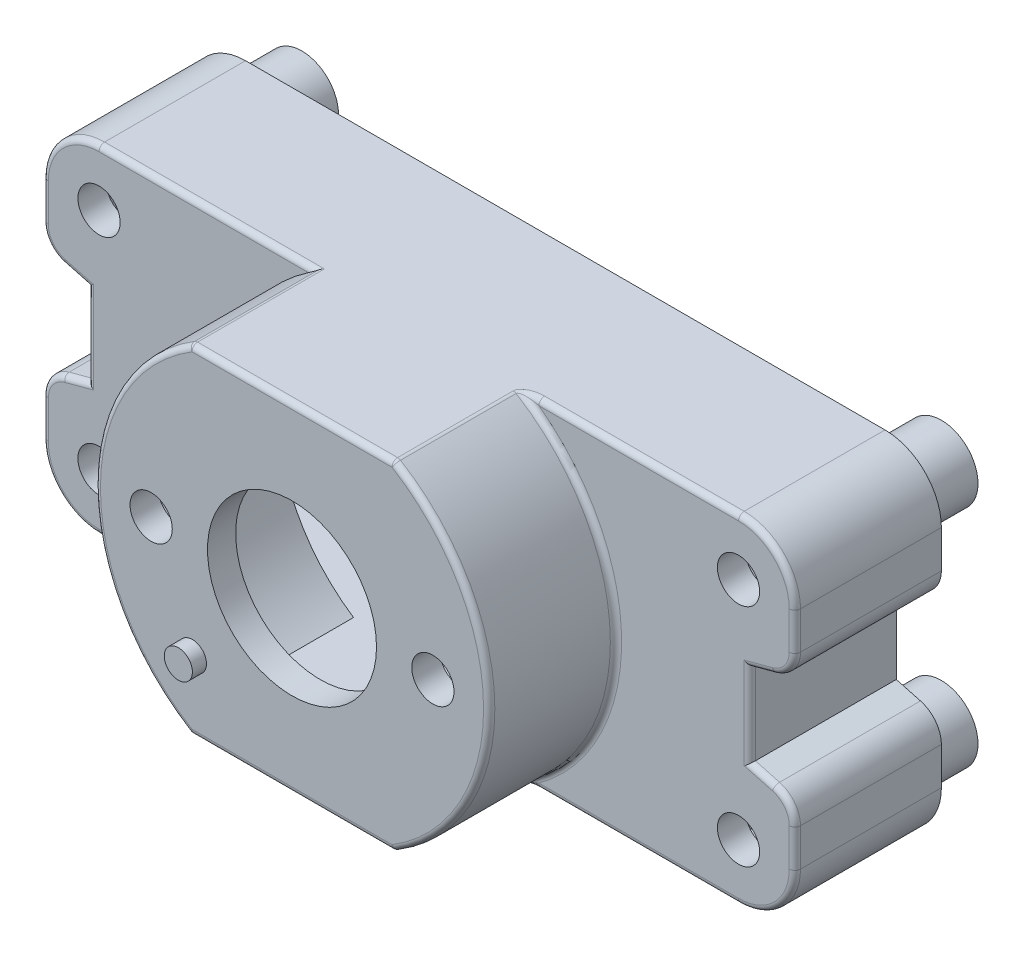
SolidWorks part; units mm, degrees
ref_plane "Plan de face" through (0, 0, 0) normal (0, 0, 1) x (1, 0, 0)
ref_plane "Plan de dessus" through (0, 0, 0) normal (0, 1, 0) x (1, 0, 0)
ref_plane "Plan de droite" through (0, 0, 0) normal (1, 0, 0) x (0, 0, -1)
sketch "Esquisse1" plane through (0, 0, 0) normal (0, 0, 1) x (1, 0, 0)
  line L0 (-9.25, -3.9) -> (-9.25, -5) construction
  line L1 (-9.25, -5) -> (9.25, -5) construction
  line L2 (9.25, -3.9) -> (9.25, -5) construction
  line L3 (10.75, 1.9635) -> (10.75, -1.9635) construction
  line L4 (9.25, 3.9) -> (9.25, 5) construction
  line L5 (-9.25, 5) -> (9.25, 5) construction
  line L6 (-9.25, 3.9) -> (-9.25, 5) construction
  line L7 (-10.75, 1.9635) -> (-10.75, -1.9635) construction
  line L8 (-9.25, -3.9) -> (-9.25, -5)
  line L9 (-9.25, -5) -> (9.25, -5)
  line L10 (9.25, -3.9) -> (9.25, -5)
  line L11 (10.75, 1.9635) -> (10.75, -1.9635)
  line L12 (11.35, 6) -> (-11.35, 6)
  line L13 (-13.35, 4) -> (-13.35, 1.9)
  line L14 (-13.35, 1.9) -> (-11.75, 1.4713)
  line L15 (-11.75, 1.4713) -> (-11.75, -1.4713)
  line L16 (-11.75, -1.4713) -> (-13.35, -1.9)
  line L17 (-13.35, -1.9) -> (-13.35, -4)
  line L18 (-11.35, -6) -> (11.35, -6)
  line L19 (13.35, -4) -> (13.35, -1.9)
  line L20 (13.35, -1.9) -> (11.75, -1.4713)
  line L21 (11.75, -1.4713) -> (11.75, 1.4713)
  line L22 (11.75, 1.4713) -> (13.35, 1.9)
  line L23 (13.35, 1.9) -> (13.35, 4)
  line L24 (11.35, 6) -> (-11.35, 6)
  line L25 (-13.35, 4) -> (-13.35, 2.6673)
  line L26 (-12.6088, 1.7014) -> (-11.75, 1.4713)
  line L27 (-11.75, 1.4713) -> (-11.75, -1.4713)
  line L28 (-11.75, -1.4713) -> (-12.6088, -1.7014)
  line L29 (-13.35, -2.6673) -> (-13.35, -4)
  line L30 (-11.35, -6) -> (11.35, -6)
  line L31 (13.35, -4) -> (13.35, -2.6673)
  line L32 (12.6088, -1.7014) -> (11.75, -1.4713)
  line L33 (11.75, -1.4713) -> (11.75, 1.4713)
  line L34 (11.75, 1.4713) -> (12.6088, 1.7014)
  line L35 (13.35, 2.6673) -> (13.35, 4)
  line L36 (9.25, 3.9) -> (9.25, 5)
  line L37 (-9.25, 5) -> (9.25, 5)
  line L38 (-9.25, 3.9) -> (-9.25, 5)
  line L39 (-10.75, 1.9635) -> (-10.75, -1.9635)
  arc A0 (-9.25, -3.9) -> (-10.75, -1.9635) centre (-11.25, -3.9) ccw construction
  arc A1 (10.75, -1.9635) -> (9.25, -3.9) centre (11.25, -3.9) ccw construction
  arc A2 (9.25, 3.9) -> (10.75, 1.9635) centre (11.25, 3.9) ccw construction
  arc A3 (-10.75, 1.9635) -> (-9.25, 3.9) centre (-11.25, 3.9) ccw construction
  arc A4 (-11.35, 6) -> (-13.35, 4) centre (-11.35, 4) ccw
  arc A5 (-13.35, -4) -> (-11.35, -6) centre (-11.35, -4) ccw
  arc A6 (11.35, -6) -> (13.35, -4) centre (11.35, -4) ccw
  arc A7 (13.35, 4) -> (11.35, 6) centre (11.35, 4) ccw
  arc A8 (-11.35, 6) -> (-13.35, 4) centre (-11.35, 4) ccw
  arc A9 (-13.35, -4) -> (-11.35, -6) centre (-11.35, -4) ccw
  arc A10 (11.35, -6) -> (13.35, -4) centre (11.35, -4) ccw
  arc A11 (13.35, 4) -> (11.35, 6) centre (11.35, 4) ccw
  arc A12 (-9.25, -3.9) -> (-10.75, -1.9635) centre (-11.25, -3.9) ccw
  arc A13 (10.75, -1.9635) -> (9.25, -3.9) centre (11.25, -3.9) ccw
  arc A14 (9.25, 3.9) -> (10.75, 1.9635) centre (11.25, 3.9) ccw
  arc A15 (-10.75, 1.9635) -> (-9.25, 3.9) centre (-11.25, 3.9) ccw
  arc A16 (13.35, 2.6673) -> (12.6088, 1.7014) centre (12.35, 2.6673) cw
  arc A17 (13.35, -2.6673) -> (12.6088, -1.7014) centre (12.35, -2.6673) ccw
  arc A18 (-13.35, -2.6673) -> (-12.6088, -1.7014) centre (-12.35, -2.6673) cw
  arc A19 (-13.35, 2.6673) -> (-12.6088, 1.7014) centre (-12.35, 2.6673) ccw
  dimension "D2" = 1
  dimension "D1" = 0
extrude "Extrusion1" add sketch "Esquisse1" along normal blind 5.2
sketch "Esquisse2" plane through (0, 0, 5.2) normal (0, 0, 1) x (1, 0, 0)
  line L12 (11.35, 6) -> (-11.35, 6)
  line L13 (-13.35, 4) -> (-13.35, 2.6673)
  line L14 (-12.6088, 1.7014) -> (-11.75, 1.4713)
  line L15 (-11.75, 1.4713) -> (-11.75, -1.4713)
  line L16 (-11.75, -1.4713) -> (-12.6088, -1.7014)
  line L17 (-13.35, -2.6673) -> (-13.35, -4)
  line L18 (-11.35, -6) -> (11.35, -6)
  line L19 (13.35, -4) -> (13.35, -2.6673)
  line L20 (12.6088, -1.7014) -> (11.75, -1.4713)
  line L21 (11.75, -1.4713) -> (11.75, 1.4713)
  line L22 (11.75, 1.4713) -> (12.6088, 1.7014)
  line L23 (13.35, 2.6673) -> (13.35, 4)
  line L24 (11.35, 6) -> (-11.35, 6)
  line L25 (-13.35, 4) -> (-13.35, 2.6673)
  line L26 (-12.6088, 1.7014) -> (-11.75, 1.4713)
  line L27 (-11.75, 1.4713) -> (-11.75, -1.4713)
  line L28 (-11.75, -1.4713) -> (-12.6088, -1.7014)
  line L29 (-13.35, -2.6673) -> (-13.35, -4)
  line L30 (-11.35, -6) -> (11.35, -6)
  line L31 (13.35, -4) -> (13.35, -2.6673)
  line L32 (12.6088, -1.7014) -> (11.75, -1.4713)
  line L33 (11.75, -1.4713) -> (11.75, 1.4713)
  line L34 (11.75, 1.4713) -> (12.6088, 1.7014)
  line L35 (13.35, 2.6673) -> (13.35, 4)
  arc A8 (13.35, 4) -> (11.35, 6) centre (11.35, 4) ccw
  arc A9 (-11.35, 6) -> (-13.35, 4) centre (-11.35, 4) ccw
  arc A10 (-13.35, 2.6673) -> (-12.6088, 1.7014) centre (-12.35, 2.6673) ccw
  arc A11 (-12.6088, -1.7014) -> (-13.35, -2.6673) centre (-12.35, -2.6673) ccw
  arc A12 (-13.35, -4) -> (-11.35, -6) centre (-11.35, -4) ccw
  arc A13 (11.35, -6) -> (13.35, -4) centre (11.35, -4) ccw
  arc A14 (13.35, -2.6673) -> (12.6088, -1.7014) centre (12.35, -2.6673) ccw
  arc A15 (12.6088, 1.7014) -> (13.35, 2.6673) centre (12.35, 2.6673) ccw
  arc A16 (13.35, 4) -> (11.35, 6) centre (11.35, 4) ccw
  arc A17 (-11.35, 6) -> (-13.35, 4) centre (-11.35, 4) ccw
  arc A18 (-13.35, 2.6673) -> (-12.6088, 1.7014) centre (-12.35, 2.6673) ccw
  arc A19 (-12.6088, -1.7014) -> (-13.35, -2.6673) centre (-12.35, -2.6673) ccw
  arc A20 (-13.35, -4) -> (-11.35, -6) centre (-11.35, -4) ccw
  arc A21 (11.35, -6) -> (13.35, -4) centre (11.35, -4) ccw
  arc A22 (13.35, -2.6673) -> (12.6088, -1.7014) centre (12.35, -2.6673) ccw
  arc A23 (12.6088, 1.7014) -> (13.35, 2.6673) centre (12.35, 2.6673) ccw
  dimension "D1" = 0
extrude "Extrusion2" add sketch "Esquisse2" against normal blind 1
sketch "Esquisse3" plane through (0, 0, 5.2) normal (0, 0, 1) x (1, 0, 0)
  line L0 (-3.6056, 6) -> (3.6056, 6)
  line L1 (11.35, 6) -> (-11.35, 6) construction
  line L2 (3.6056, -6) -> (-3.6056, -6)
  line L3 (-11.35, -6) -> (11.35, -6) construction
  arc A0 (-3.6056, 6) -> (-3.6056, -6) centre (0, 0) ccw
  arc A1 (3.6056, -6) -> (3.6056, 6) centre (0, 0) ccw
  dimension "D1" = 14
extrude "Extrusion3" add sketch "Esquisse3" along normal blind 4.5
shell "Coque1" thickness 1
sketch "Esquisse4" plane through (0, 0, 0) normal (0, 0, -1) x (-1, 0, 0)
  circle A0 centre (-11.35, -4) radius 1.3 construction
  circle A1 centre (-11.35, 4) radius 1.3 construction
  circle A2 centre (11.35, -4) radius 1.3 construction
  circle A3 centre (11.35, 4) radius 1.3 construction
  circle A4 centre (-11.35, -4) radius 1.3
  circle A5 centre (-11.35, 4) radius 1.3
  circle A6 centre (11.35, -4) radius 1.3
  circle A7 centre (11.35, 4) radius 1.3
extrude "Extrusion4" add sketch "Esquisse4" along normal up to surface (2 mm away)
sketch "Esquisse5" plane through (0, 0, -2) normal (0, 0, -1) x (-1, 0, 0)
  line L1 (0, -7.283) -> (0, 7.9067) construction
  line L5 (14.2543, 0) -> (-14.2543, 0) construction
  circle A0 centre (0, 0) radius 3
  circle A2 centre (11.35, 4) radius 0.75 construction
  circle A3 centre (-11.35, 4) radius 0.75 construction
  circle A4 centre (-11.35, -4) radius 0.75 construction
  circle A5 centre (11.35, -4) radius 0.75 construction
  circle A6 centre (-11.35, 4) radius 0.75
  circle A7 centre (-11.35, -4) radius 0.75
  circle A8 centre (11.35, -4) radius 0.75
  circle A9 centre (11.35, 4) radius 0.75
  circle A10 centre (-5, 0) radius 0.75
  circle A11 centre (5, 0) radius 0.75
  dimension "D1" = 6
  dimension "D2" = 10
  dimension "D3" = 1.5
  dimension "D4" = 1.5
extrude "Enlèv. mat.-Extru.1" cut sketch "Esquisse5" against normal through all
sketch "Esquisse6" plane through (0, 0, 4.2) normal (0, 0, -1) x (-1, 0, 0)
  line L2 (-5.875, 1.2183) -> (5.875, 1.2183)
  line L3 (5.875, -1.2183) -> (-5.875, -1.2183)
  arc A0 (-5.875, 1.2183) -> (-5.875, -1.2183) centre (-5, 0) ccw
  arc A2 (5.875, 1.2183) -> (5.875, -1.2183) centre (5, 0) cw
  circle A4 centre (5, 0) radius 0.75 construction
  circle A5 centre (-5, 0) radius 0.75 construction
  arc A9 (3.3166, -5) -> (3.3166, 5) centre (0, 0) ccw construction
  arc A10 (-3.3166, 5) -> (-3.3166, -5) centre (0, 0) ccw construction
  dimension "D1" = 1.5
  dimension "D2" = 1.5
extrude "Enlèv. mat.-Extru.2" cut sketch "Esquisse6" against normal up to surface (4.5 mm away)
sketch "Esquisse7" plane through (0, 0, 9.7) normal (0, 0, 1) x (1, 0, 0)
  line L2 (5, 0) -> (-14.2543, 0) construction
  line L3 (0, 0) -> (-3.5355, -3.5355) construction
  circle A0 centre (-3.5355, -3.5355) radius 0.5
  circle A4 centre (0, 0) radius 5 construction
  circle A5 centre (5, 0) radius 0.75 construction
  point P4 (5, 0)
  dimension "D1" = 1
  dimension "D3" = 45
extrude "Extrusion5" add sketch "Esquisse7" along normal blind 0.5
fillet "Congé1" radius 0.2 31 edges at (-12.7642, 5.4142, 5.2) (-13.35, 3.3337, 5.2) (-13.1434, 2.0586, 5.2) (-12.1794, -1.5863, 5.2) (-13.1434, -2.0586, 5.2) (-13.35, -3.3337, 5.2) (-12.7642, -5.4142, 5.2) (12.7642, 5.4142, 5.2) (13.35, 3.3337, 5.2) (13.1434, 2.0586, 5.2) (12.1794, -1.5863, 5.2) (13.1434, -2.0586, 5.2) (13.35, -3.3337, 5.2) (12.7642, -5.4142, 5.2) (0, 6, 9.7) (-7, 0, 9.7) (0, -6, 9.7) (7, 0, 9.7) (-12.1794, 1.5863, 5.2) (-11.75, 0, 5.2) (12.1794, 1.5863, 5.2) (11.75, 0, 5.2)
